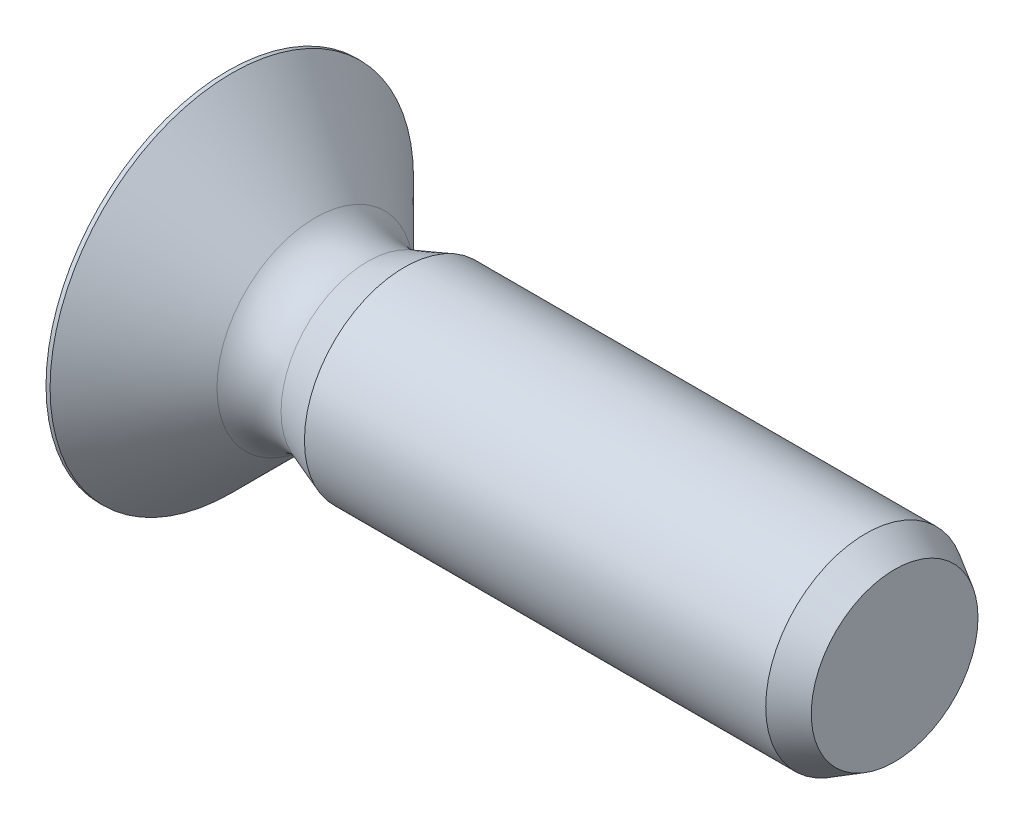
SolidWorks part; units mm, degrees
ref_plane "Front" through (0, 0, 0) normal (0, 0, 1) x (1, 0, 0)
ref_plane "Top" through (0, 0, 0) normal (0, 1, 0) x (1, 0, 0)
ref_plane "Right" through (0, 0, 0) normal (1, 0, 0) x (0, 0, -1)
other "Configuration Table"
sketch "Sketch1" plane through (0, 0, 0) normal (0, 0, 1) x (1, 0, 0)
  line L0 (-38.1054, 0) -> (11.3165, 0) construction
  line L1 (20, 0) -> (20, 3)
  line L2 (20, 3) -> (5.3, 3)
  line L3 (5.3, 3) -> (3.3, 2.2721)
  line L4 (3.3, 2.2721) -> (0.1221, 5.45)
  line L5 (20, 0) -> (0, 0)
  line L6 (0.1221, 5.45) -> (0, 5.45)
  line L7 (0, 5.45) -> (0, 0)
revolve "Base" add sketch "Sketch1" angle 360 about L0
sketch "Sketch2" plane through (0, 0, 0) normal (0, 1, 0) x (1, 0, 0)
  line L0 (21.3282, 0) -> (6.3612, 0) construction
  line L2 (19.134, -3) -> (20, -2.5)
  line L6 (20, -2.5) -> (20, -3)
  line L7 (20, -3) -> (19.134, -3)
revolve "BaseEnd" cut sketch "Sketch2" angle 360 about L0
sketch "Sketch3" plane through (0, 0, 0) normal (1, 0, 0) x (0, 0, -1)
  line L0 (0, 0) -> (-3.9695, 0) construction
  line L1 (0, 0) -> (0, 3.5828) construction
  line L2 (0.73, 3.65) -> (-0.73, 3.65)
  line L3 (-0.73, 3.65) -> (-0.73, 0.73)
  line L4 (-0.73, 0.73) -> (-3.65, 0.73)
  line L5 (-3.65, 0.73) -> (-3.65, -0.73)
  line L6 (-0.73, -0.73) -> (-3.65, -0.73)
  line L7 (-0.73, -3.65) -> (-0.73, -0.73)
  line L8 (0.73, -3.65) -> (-0.73, -3.65)
  line L9 (0.73, -3.65) -> (0.73, -0.73)
  line L10 (0.73, -0.73) -> (3.65, -0.73)
  line L11 (3.65, 0.73) -> (3.65, -0.73)
  line L12 (0.73, 0.73) -> (3.65, 0.73)
  line L13 (0.73, 3.65) -> (0.73, 0.73)
  point P4 (3.65, 0)
  point P10 (-3.65, 0)
  point P14 (0, -3.65)
  point P19 (0, 3.65)
extrude "CrossRecess" cut sketch "Sketch3" along normal blind 1.65
draft "Draft1" type of draft neutral plane draft angle 45 faces to draft 4 parameters "D1"=45
fillet "Fillet1" radius 1.5 1 edges at (3.3, 0, 2.2721)
sketch "Sketch5" plane through (0, 0, 0) normal (0, 0, 1) x (1, 0, 0)
  line L0 (19.1269, 3.0141) -> (19.141, 3.0141)
  line L1 (19.141, 3.0141) -> (19.141, 3)
  line L2 (19.141, 3) -> (19.134, 2.9878)
  line L3 (19.134, 2.9878) -> (19.1269, 3)
  line L4 (19.1269, 3) -> (19.1269, 3.0141)
  line L5 (0, 0) -> (20.5492, 0) construction
  line L6 (0, 5.45) -> (0, -5.45) construction
  line L7 (19.134, 3) -> (19.134, -3) construction
revolve "Cut-Revolve10" [suppressed] cut sketch "Sketch5" angle 360 about L5
pattern_linear "LPattern10" [suppressed] count 862 spacing 0.0171 along (1, 0, 0)
sketch "Sketch4" plane through (0, 0, 0) normal (0, 0, 1) x (1, 0, 0)
  line L0 (14.0155, 0) -> (-1.5304, 0) construction
  line L1 (2.6243, 2.9478) -> (0.1221, 5.45) construction
  line L2 (3.3125, 2.9878) -> (8.8873, 2.9878)
  line L3 (8.8873, 2.9878) -> (10.1774, 3)
  line L4 (2.5721, 3) -> (3.2875, 2.988)
  line L5 (10.1774, 3) -> (2.5721, 3)
  line L7 (20, -2.5) -> (20, 2.5) construction
  arc A0 (3.3125, 2.9878) -> (3.2875, 2.988) centre (3.3125, 4.4878) cw
  point P14 (3.3, 2.9878)
revolve "Cut-Revolve2" [suppressed] cut sketch "Sketch4" angle 360 about L0
equation "\"D2@ThreadCosmetic1\" = \"d@Sketch1\" - 1"
equation "\"D2@Sketch2\" = \"D2@ThreadCosmetic1\""
equation "\"D3@Sketch2\" = \"d@Sketch1\""
equation "\"D2@Sketch3\" = \"m@Sketch3\" / 5"
equation "\"D1@Sketch4\" = \"d@Sketch1\" / 2 - \"a@Sketch1\" * tan ( 3.14 / 9 ) "
equation "\"D1@CrossRecess\" = \"k@Sketch1\" /2"
equation "\"D2@Sketch4\" = \"l@Sketch1\" - \"k@Sketch1\""
equation "\"D3@Sketch4\" = \"r@Fillet1\""
equation "\"D4@Sketch4\" = \"d@Sketch1\""
equation "\"D1@Sketch5\" = \"d@Sketch1\""
equation "\"D2@Sketch5\" = \"d@Sketch1\" / 2 - \"a@Sketch1\" * tan ( 3.14 / 9 ) "
equation "\"D3@LPattern10\" = (  \"D1@Sketch5\" / 2 - \"D2@Sketch5\" )  * 1.4"
equation "\"D1@LPattern10\" = (  \"l@Sketch1\" - \"k@Sketch1\" - \"a@Sketch1\" )  / \"D3@LPattern10\""
